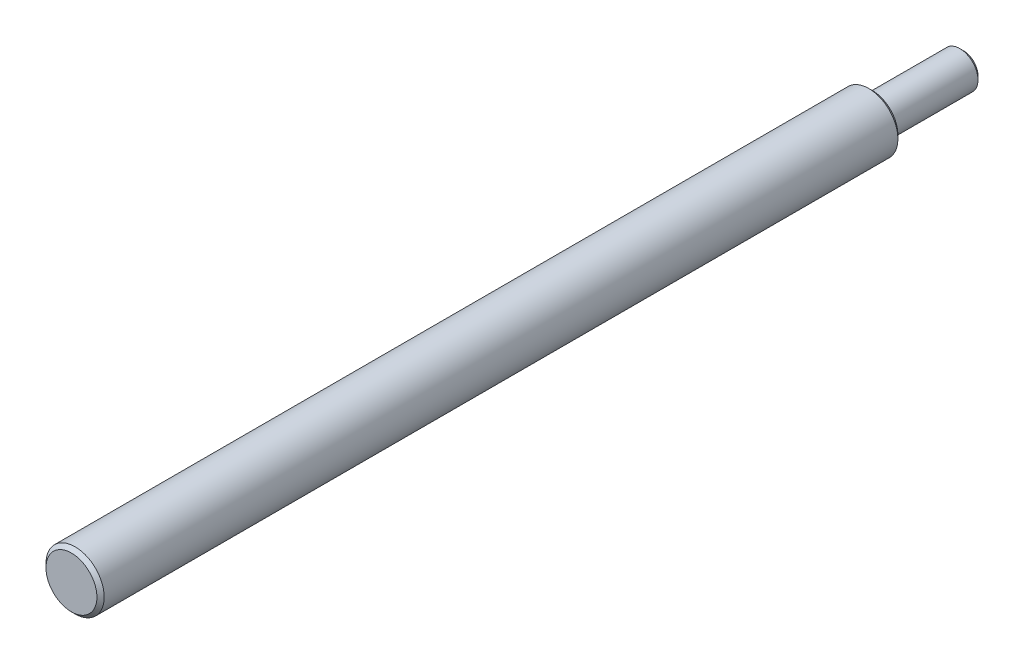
SolidWorks part; units mm, degrees
ref_plane "前视基准面" through (0, 0, 0) normal (0, 0, 1) x (1, 0, 0)
ref_plane "上视基准面" through (0, 0, 0) normal (0, 1, 0) x (1, 0, 0)
ref_plane "右视基准面" through (0, 0, 0) normal (1, 0, 0) x (0, 0, -1)
sketch "草图1" plane through (0, 0, 0) normal (0, 0, 1) x (1, 0, 0)
  circle A0 centre (0, 0) radius 8
extrude "凸台-拉伸1" add sketch "草图1" along normal blind 220
sketch "草图2" plane through (0, 0, 0) normal (0, 0, -1) x (-1, 0, 0)
  circle A0 centre (0, 0) radius 5
extrude "凸台-拉伸2" add sketch "草图2" along normal blind 25
chamfer "倒角1" distance 1 angle 45 3 edges at (8, 0, 220) (-5, 0, -25) (8, 0, 0)
